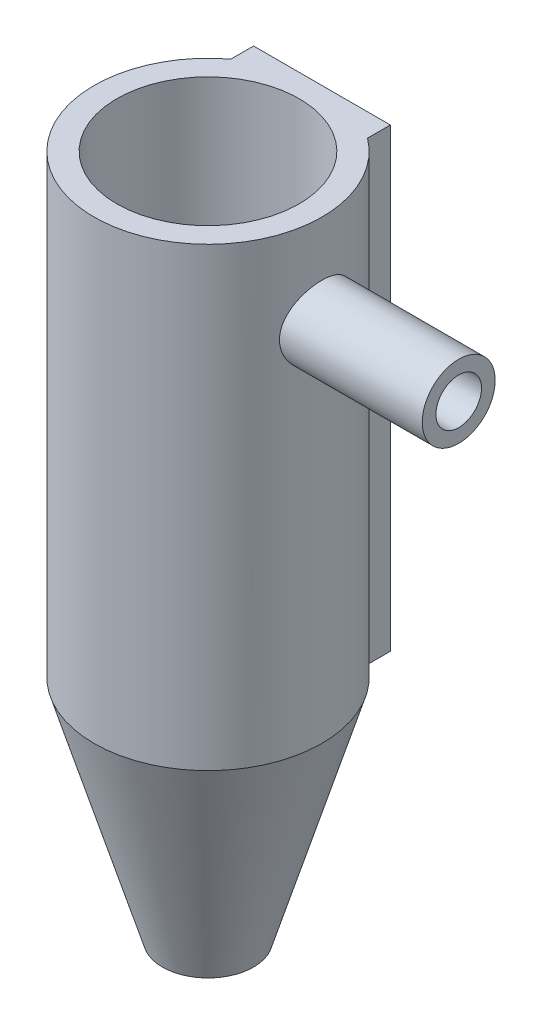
SolidWorks part; units mm, degrees
ref_plane "Front Plane" through (0, 0, 0) normal (0, 0, 1) x (1, 0, 0)
ref_plane "Top Plane" through (0, 0, 0) normal (0, 1, 0) x (1, 0, 0)
ref_plane "Right Plane" through (0, 0, 0) normal (1, 0, 0) x (0, 0, -1)
sketch "Sketch_Nuzzle Vent" plane through (0, 0, 0) normal (0, 1, 0) x (1, 0, 0)
  line L0 (0, 0) -> (0, 10) construction
  circle A0 centre (0, 0) radius 5 construction
  circle A1 centre (0, 0) radius 10
  dimension "D2" = 10
  dimension "D1" = 5
ref_plane "Plane_Nuzzle Neck" through (0, 50, 0) normal (0, 1, 0) x (1, 0, 0)
sketch "Sketch_Nuzzle Path" plane through (0, 50, 0) normal (0, 1, 0) x (1, 0, 0)
  line L0 (0, 0) -> (0, 25) construction
  circle A0 centre (0, 0) radius 25
  point P8 (0, 25)
  dimension "D1" = 50
loft "Loft_Nuzzle" add profiles "Sketch_Nuzzle Vent", "Sketch_Nuzzle Path"
sketch "Sketch_Nuzzle Neck" plane through (0, 50, 0) normal (0, 1, 0) x (1, 0, 0)
  circle A1 centre (0, 0) radius 25
  circle A2 centre (0, 0) radius 25
  dimension "D1" = 0
extrude "Nuzzle Neck" add sketch "Sketch_Nuzzle Neck" along normal blind 100
shell "Shell_Nuzzle Pathway" thickness 5
sketch "Sketch_Toothpaste Inlet" plane through (0, 0, 0) normal (1, 0, 0) x (0, 0, -1)
  line L0 (0, 130) -> (0, 0) construction
  circle A0 centre (0, 130) radius 5
  dimension "D1" = 10
  dimension "D2" = 130
extrude "Cut_Toothpaste Inlet" cut sketch "Sketch_Toothpaste Inlet" along normal through all
ref_plane "Plane_Mounting" through (0, 0, -25) normal (0, 0, -1) x (-1, 0, 0)
sketch "Sketch_Mounting" plane through (0, 0, -25) normal (0, 0, -1) x (-1, 0, 0)
  line L0 (0, 0) -> (0, 150) construction
  line L1 (-15, 150) -> (15, 150)
  line L2 (-15, 150) -> (-15, 50)
  line L3 (-15, 50) -> (15, 50)
  line L4 (15, 150) -> (15, 50)
  line L5 (20, 150) -> (-20, 150) construction
  line L6 (25, 50) -> (-25, 50) construction
  dimension "D1" = 30
extrude "Mounting" add sketch "Sketch_Mounting" against normal up to surface
ref_plane "Plane_Toothpaste Tube" through (25, 0, 0) normal (1, 0, 0) x (0, 0, -1)
sketch "Sketch_Toothpaste Tube" plane through (25, 0, 0) normal (1, 0, 0) x (0, 0, -1)
  circle A0 centre (0, 130) radius 5 construction
  circle A1 centre (0, 130) radius 5
  circle A2 centre (0, 130) radius 8
  dimension "D1" = 3
extrude "Toothpaste Tube" add sketch "Sketch_Toothpaste Tube" along normal blind 30 and the other way up to next
